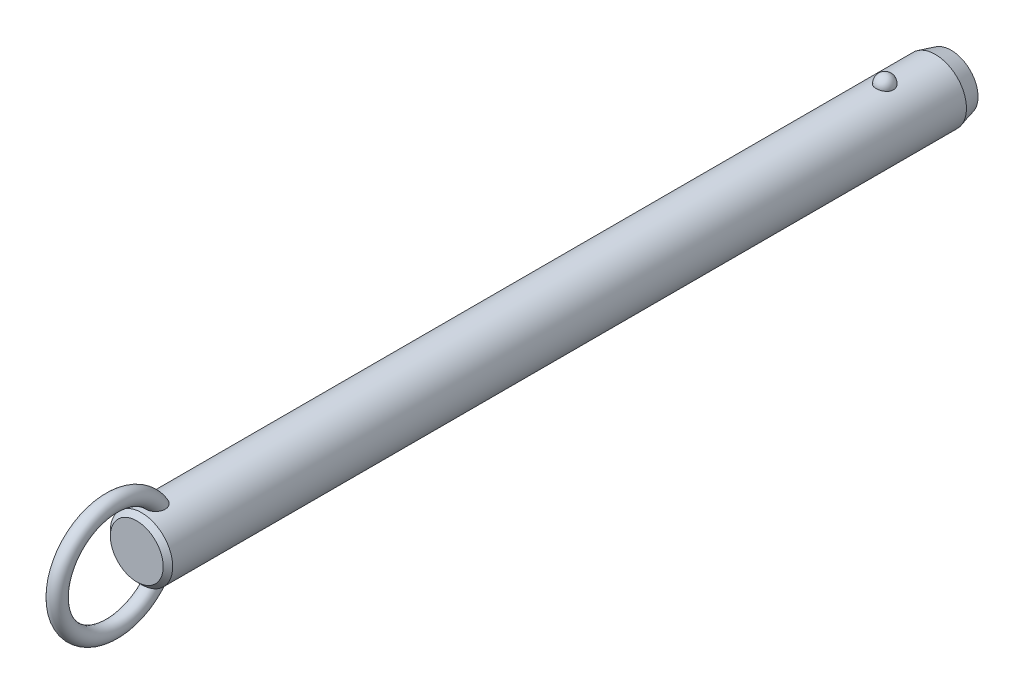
SolidWorks part; units mm, degrees
ref_plane "Front Plane" through (0, 0, 0) normal (0, 0, 1) x (1, 0, 0)
ref_plane "Top Plane" through (0, 0, 0) normal (0, 1, 0) x (1, 0, 0)
ref_plane "Right Plane" through (0, 0, 0) normal (1, 0, 0) x (0, 0, -1)
sketch "Sketch2" plane through (0, 0, 0) normal (0, 0, 1) x (1, 0, 0)
  circle A0 centre (0, 0) radius 7.9
  point P3 (0, 7.9)
  dimension "D1" = 15.8
extrude "Boss-Extrude1" add sketch "Sketch2" along normal blind 177.8
sketch "Sketch3" plane through (0, 0, 0) normal (0, 0, -1) x (-1, 0, 0)
  circle A0 centre (0, 0) radius 7.9
  dimension "D1" = 15.8
extrude "Boss-Extrude2" add sketch "Sketch3" along normal blind 19
chamfer "Chamfer1" distance 4 angle 15 1 edges at (-7.9, 0, -19)
sketch "Sketch12" plane through (0, 0, 0) normal (1, 0, 0) x (0, 0, -1)
  line L0 (-177.8, 7.9) -> (-177.8, -7.9) construction
  point P0 (-177.8, 0)
sketch "Sketch13" plane through (0, 0, 0) normal (1, 0, 0) x (0, 0, -1)
  circle A0 centre (-193.65, 0) radius 15.85
  point P2 (-177.8, 0)
  dimension "D1" = 31.7
sketch "Sketch14" plane through (0, 0, 0) normal (0, 1, 0) x (1, 0, 0)
  circle A0 centre (0, -179.8) radius 2
  point P2 (0, -177.8)
  dimension "D1" = 4
sweep "Sweep1" add profiles "Sketch14" path "Sketch13"
sketch "Sketch15" plane through (0, 0, 177.8) normal (0, 0, 1) x (1, 0, 0)
  circle A0 centre (0, 0) radius 7.9
  dimension "D1" = 15.8
extrude "Boss-Extrude3" add sketch "Sketch15" along normal blind 9.52
chamfer "Chamfer2" distance 1.2 angle 45 1 edges at (7.9, 0, 187.32)
sketch "Sketch18" plane through (0, 0, 0) normal (1, 0, 0) x (0, 0, -1)
  line L0 (15, 7.9) -> (-179.9091, 7.9) construction
  line L1 (2.2, 10.1) -> (2.2, 5.7)
  line L2 (-179.9091, -7.9) -> (15, -7.9) construction
  arc A0 (2.2, 10.1) -> (2.2, 5.7) centre (2.2, 7.9) ccw
  point P4 (0, 7.9)
  dimension "D1" = 18
revolve "Revolve1" add sketch "Sketch18" angle 360 about L1
